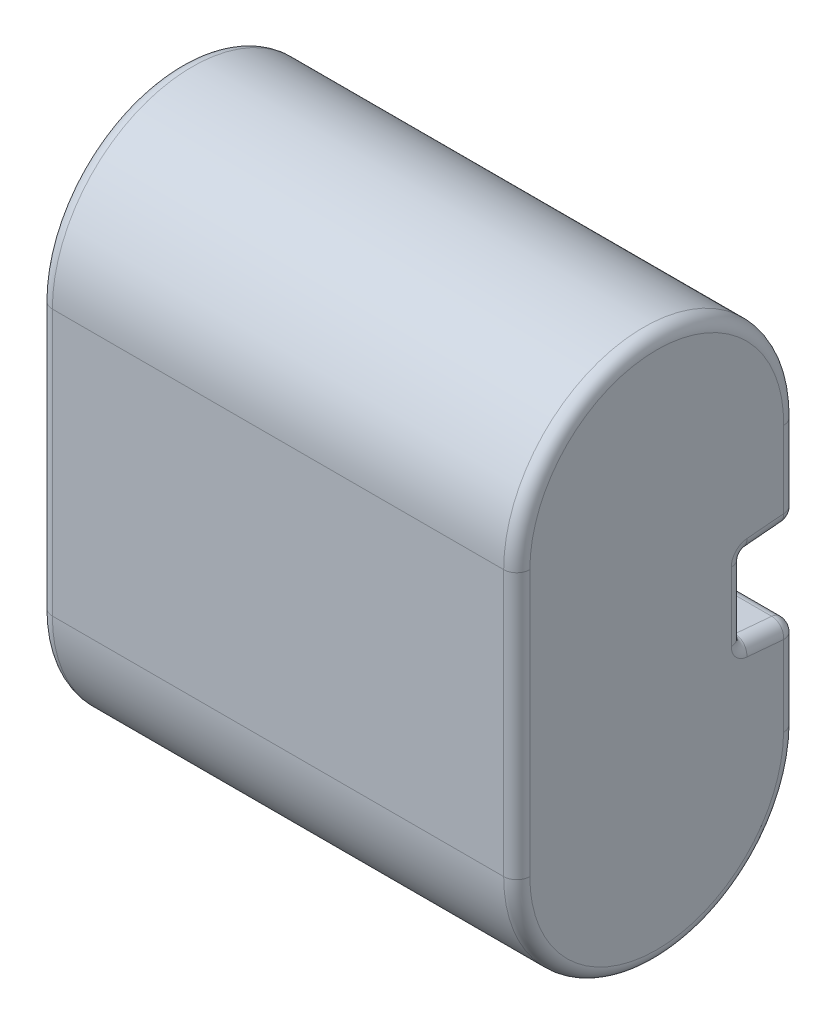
SolidWorks part; units mm, degrees
ref_plane "Plan de face" through (0, 0, 0) normal (0, 0, 1) x (1, 0, 0)
ref_plane "Plan de dessus" through (0, 0, 0) normal (0, 1, 0) x (1, 0, 0)
ref_plane "Plan de droite" through (0, 0, 0) normal (1, 0, 0) x (0, 0, -1)
imported_body "Importée1"
other "Congé3"
